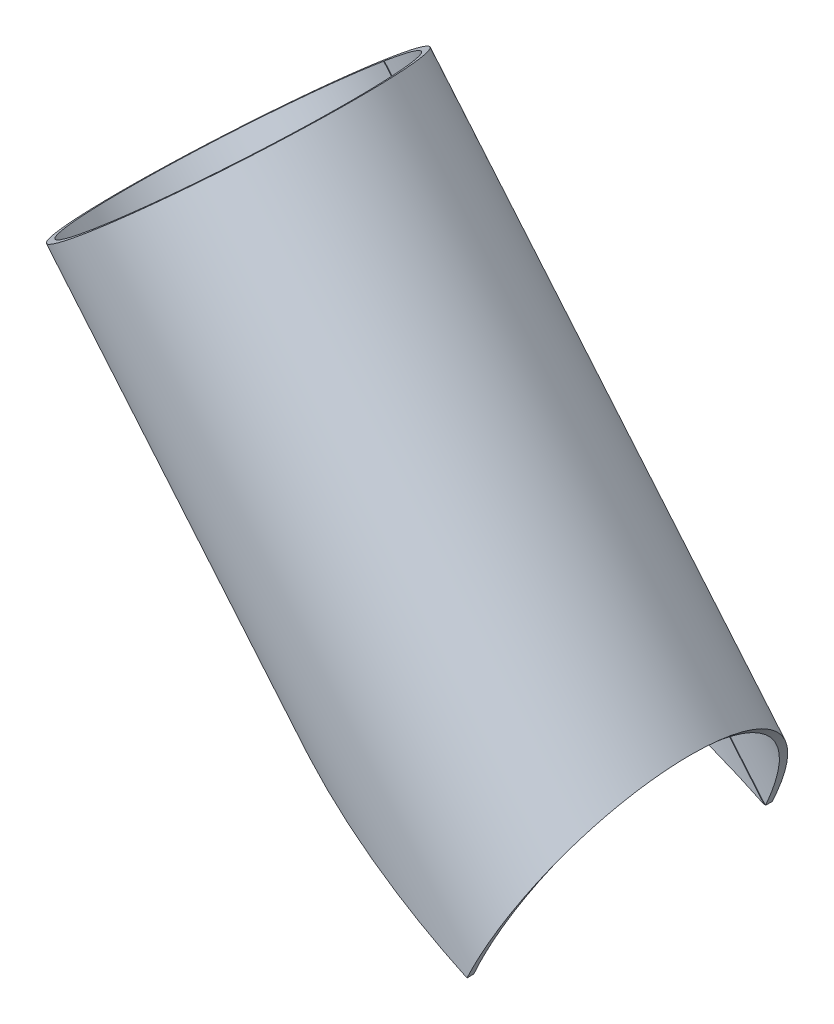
SolidWorks part; units mm, degrees
ref_plane "前视基准面" through (0, 0, 0) normal (0, 0, 1) x (1, 0, 0)
ref_plane "上视基准面" through (0, 0, 0) normal (0, 1, 0) x (1, 0, 0)
ref_plane "右视基准面" through (0, 0, 0) normal (1, 0, 0) x (0, 0, -1)
imported_body "基体零件-等径斜交三通管-1"
sheet metal parameters "钣金1" parameters "D1"=0.7366, "厚度"=8
bend "圆角折弯1" bend radius 172 bend angle 359.682 parameters "D5"=1
flatten bends "展开-折弯1"
sketch "尖角-草图1" plane through (-224.6676, 268.5263, -179.9993) normal (0.0021, 0.0018, -1) x (-1, 0, -0.0021)
  line L0 (-638.2, 79.3221) -> (-188.6672, 615.0523) construction
  dimension "D1" = 0
process bends "加工-折弯1" parameters "D1"=0
sketch "平面-草图1" plane through (-224.6676, 268.5263, -179.9993) normal (0.0021, 0.0018, -1) x (-1, 0, -0.0021)
